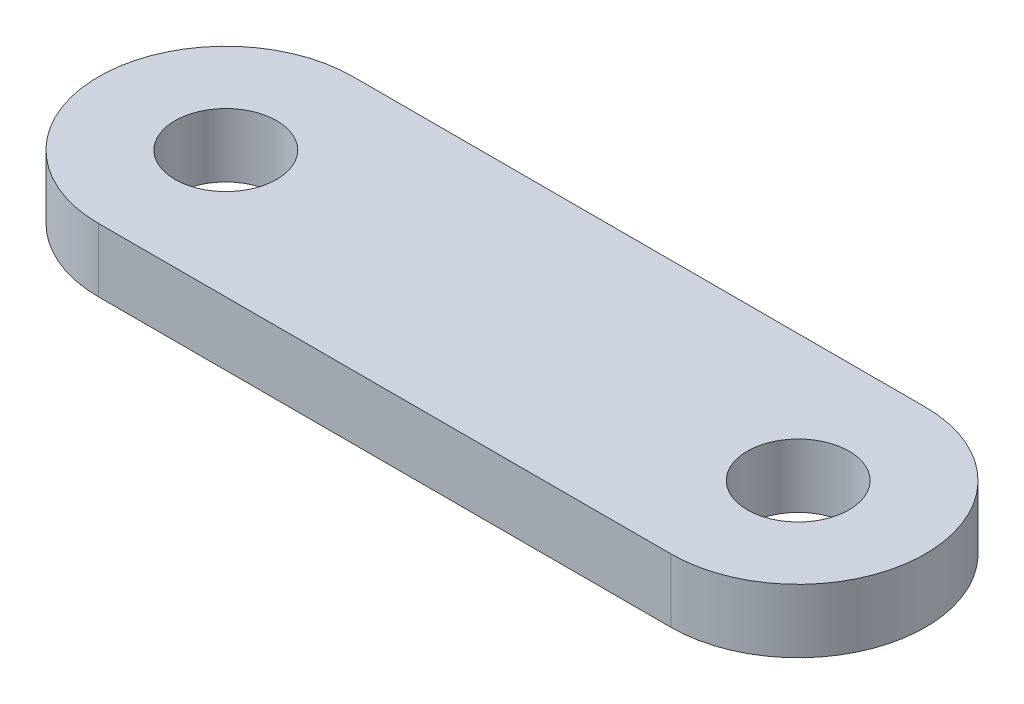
SolidWorks part; units mm, degrees
ref_plane "Спереди" through (0, 0, 0) normal (0, 0, 1) x (1, 0, 0)
ref_plane "Сверху" through (0, 0, 0) normal (0, 1, 0) x (1, 0, 0)
ref_plane "Справа" through (0, 0, 0) normal (1, 0, 0) x (0, 0, -1)
sketch "Эскиз1" plane through (0, 0, 0) normal (0, 1, 0) x (1, 0, 0)
  line L1 (0, 0) -> (18, 0)
  line L3 (0, -8) -> (18, -8)
  arc A0 (0, 0) -> (0, -8) centre (0, -4) ccw
  arc A1 (18, 0) -> (18, -8) centre (18, -4) cw
  circle A2 centre (0, -4) radius 1.6
  circle A3 centre (18, -4) radius 1.6
  dimension "D1" = 18
  dimension "D2" = 8
extrude "Бобышка-Вытянуть1" add sketch "Эскиз1" along normal blind 2
